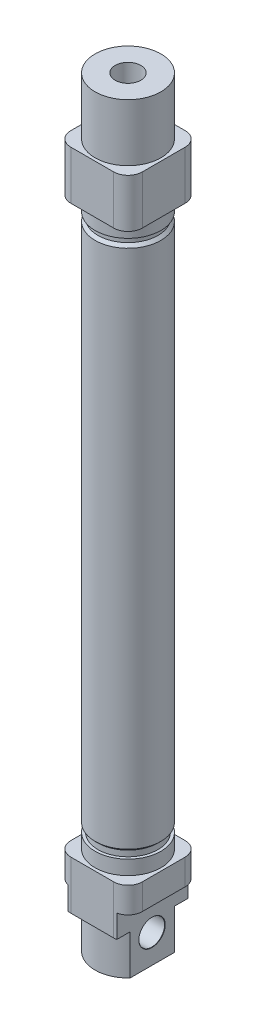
SolidWorks part; units mm, degrees
ref_plane "Plan de face" through (0, 0, 0) normal (0, 0, 1) x (1, 0, 0)
ref_plane "Plan de dessus" through (0, 0, 0) normal (0, 1, 0) x (1, 0, 0)
ref_plane "Plan de droite" through (0, 0, 0) normal (1, 0, 0) x (0, 0, -1)
sketch "Esquisse1" plane through (0, 0, 0) normal (0, 0, 1) x (1, 0, 0)
  line L0 (0, 551.0925) -> (0, 0) construction
  line L1 (11.5, 190) -> (11.5, 8)
  line L2 (11.5, 190) -> (10.5, 191)
  line L3 (10.5, 191) -> (10.5, 193)
  line L4 (10.5, 193) -> (11.5, 193)
  line L5 (11.5, 193) -> (11.5, 198)
  line L6 (11.5, 8) -> (10.5, 7)
  line L7 (10.5, 7) -> (10.5, 5)
  line L8 (10.5, 5) -> (11.5, 5)
  line L9 (11.5, 5) -> (11.5, 0)
  line L10 (11.5, 198) -> (0, 198)
  line L11 (11.5, 0) -> (0, 0)
  line L12 (0, 0) -> (0, 198)
  dimension "D1" = 11.5
  dimension "D2" = 5
  dimension "D3" = 1
  dimension "D4" = 1
  dimension "D5" = 2
  dimension "D6" = 1
  dimension "D7" = 1
  dimension "D8" = 2
  dimension "D9" = 1
  dimension "D10" = 5
  dimension "D11" = 182
revolve "Révolution1" add sketch "Esquisse1" angle 360 about L0
sketch "Esquisse2" plane through (0, 198, 0) normal (0, 1, 0) x (1, 0, 0)
  line L1 (-12.5, 12.5) -> (12.5, 12.5)
  line L2 (-12.5, 12.5) -> (-12.5, -12.5)
  line L3 (-12.5, -12.5) -> (12.5, -12.5)
  line L4 (12.5, 12.5) -> (12.5, -12.5)
  dimension "D1" = 12.5
  dimension "D2" = 12.5
  dimension "D3" = 12.5
  dimension "D4" = 12.5
extrude "Extrusion1" add sketch "Esquisse2" along normal blind 17
sketch "Esquisse3" plane through (0, 0, 0) normal (0, -1, 0) x (1, 0, 0)
  line L1 (-12.5, 12.5) -> (12.5, 12.5)
  line L2 (-12.5, 12.5) -> (-12.5, -12.5)
  line L3 (-12.5, -12.5) -> (12.5, -12.5)
  line L4 (12.5, 12.5) -> (12.5, -12.5)
extrude "Extrusion2" add sketch "Esquisse3" along normal blind 17
sketch "Esquisse4" plane through (0, 215, 0) normal (0, 1, 0) x (1, 0, 0)
  circle A0 centre (0, 0) radius 11.5
  dimension "D1" = 23
extrude "Extrusion3" add sketch "Esquisse4" along normal blind 20
sketch "Esquisse5" plane through (0, -17, 0) normal (0, -1, 0) x (1, 0, 0)
  circle A0 centre (0, 0) radius 11.5
  dimension "D1" = 23
extrude "Extrusion4" add sketch "Esquisse5" along normal blind 14
fillet "Congé1" radius 5 8 edges at (-12.5, 206.5, 12.5) (-12.5, 206.5, -12.5) (12.5, 206.5, -12.5) (12.5, 206.5, 12.5) (12.5, -8.5, 12.5) (12.5, -8.5, -12.5) (-12.5, -8.5, -12.5) (-12.5, -8.5, 12.5)
sketch "Esquisse6" plane through (0, -31, 0) normal (0, -1, 0) x (1, 0, 0)
  line L0 (12.5, -7.5) -> (12.5, 7.5) construction
  line L1 (8.5, 13.4444) -> (14.6111, 13.4444)
  line L2 (8.5, 13.4444) -> (8.5, -13.2593)
  line L3 (8.5, -13.2593) -> (14.6111, -13.2593)
  line L4 (14.6111, 13.4444) -> (14.6111, -13.2593)
  line L5 (-12.5, 7.5) -> (-12.5, -7.5) construction
  line L6 (-8.5, 13.4444) -> (-14.0185, 13.4444)
  line L7 (-8.5, 13.4444) -> (-8.5, -13.5926)
  line L8 (-8.5, -13.5926) -> (-14.0185, -13.5926)
  line L9 (-14.0185, 13.4444) -> (-14.0185, -13.5926)
  dimension "D1" = 4
  dimension "D2" = 4
extrude "Enlèv. mat.-Extru.1" cut sketch "Esquisse6" against normal blind 22
sketch "Esquisse7" plane through (8.5, 0, 0) normal (1, 0, 0) x (0, 0, -1)
  line L0 (-12.399, -9) -> (12.399, -9) construction
  line L1 (12.399, -17) -> (12.399, -9) construction
  circle A0 centre (-0.101, -21) radius 4.5
  dimension "D1" = 9
  dimension "D2" = 12
  dimension "D3" = 12.5
extrude "Enlèv. mat.-Extru.2" cut sketch "Esquisse7" against normal through all
chamfer "Chanfrein1" distance 0.1 angle 45 2 edges at (-8.5, -21, -4.399) (8.5, -21, -4.399)
hole_wizard "Trou taraudé M121" positions "Esquisse9" profile "Esquisse8" tap size "M12" standard "ISO"
sketch "Esquisse9" plane through (0, 0, -12.5) normal (0, 0, -1) x (-1, 0, 0)
  line L0 (12.5, 0) -> (12.5, -9) construction
  line L1 (7.5, 0) -> (-7.5, 0) construction
  point P0 (0, -9)
  dimension "D1" = 12.5
  dimension "D2" = 9
sketch "Esquisse8" plane through (0, -9, -12.5) normal (1, 0, 0) x (0, 1, 0)
  line L0 (0, 0) -> (0, 23.0644)
  line L1 (0, 23.0644) -> (5.1, 20)
  line L2 (5.1, 20) -> (5.1, 0)
  line L5 (5.1, 0) -> (0, 0)
  line L10 (0, 23.0644) -> (-5.1, 20) construction
  line L11 (0, -6.35) -> (0, 107.95) construction
  dimension "Diamètre du trou pour taraudage" = 10.2
  dimension "Profondeur du trou pour taraudage" = 20
  dimension "Angle de pointe" = 118
hole_wizard "Trou taraudé M122" positions "Esquisse11" profile "Esquisse10" tap size "M12" standard "ISO"
sketch "Esquisse11" plane through (0, 0, -12.5) normal (0, 0, -1) x (-1, 0, 0)
  line L0 (12.5, 215) -> (12.5, 198) construction
  line L1 (-7.5, 215) -> (7.5, 215) construction
  point P0 (0, 206)
  dimension "D1" = 12.5
  dimension "D2" = 9
sketch "Esquisse10" plane through (0, 206, -12.5) normal (1, 0, 0) x (0, 1, 0)
  line L0 (0, 0) -> (0, 23.0644)
  line L1 (0, 23.0644) -> (5.1, 20)
  line L2 (5.1, 20) -> (5.1, 0)
  line L5 (5.1, 0) -> (0, 0)
  line L10 (0, 23.0644) -> (-5.1, 20) construction
  line L11 (0, -6.35) -> (0, 107.95) construction
  dimension "Diamètre du trou pour taraudage" = 10.2
  dimension "Profondeur du trou pour taraudage" = 20
  dimension "Angle de pointe" = 118
sketch "Esquisse12" plane through (0, 235, 0) normal (0, 1, 0) x (1, 0, 0)
  circle A0 centre (0, 0) radius 4.5
  dimension "D1" = 9
extrude "Enlèv. mat.-Extru.3" cut sketch "Esquisse12" against normal blind 45
sketch "Esquisse13" plane through (0, 190, 0) normal (0, 1, 0) x (1, 0, 0)
  circle A0 centre (0, 0) radius 5.5
  dimension "D1" = 11
extrude "Enlèv. mat.-Extru.4" cut sketch "Esquisse13" against normal blind 170
sketch "Esquisse14" plane through (0, 20, 0) normal (0, 1, 0) x (1, 0, 0)
  circle A0 centre (0, 0) radius 0.5
  dimension "D1" = 1
extrude "Enlèv. mat.-Extru.5" cut sketch "Esquisse14" against normal up to next
